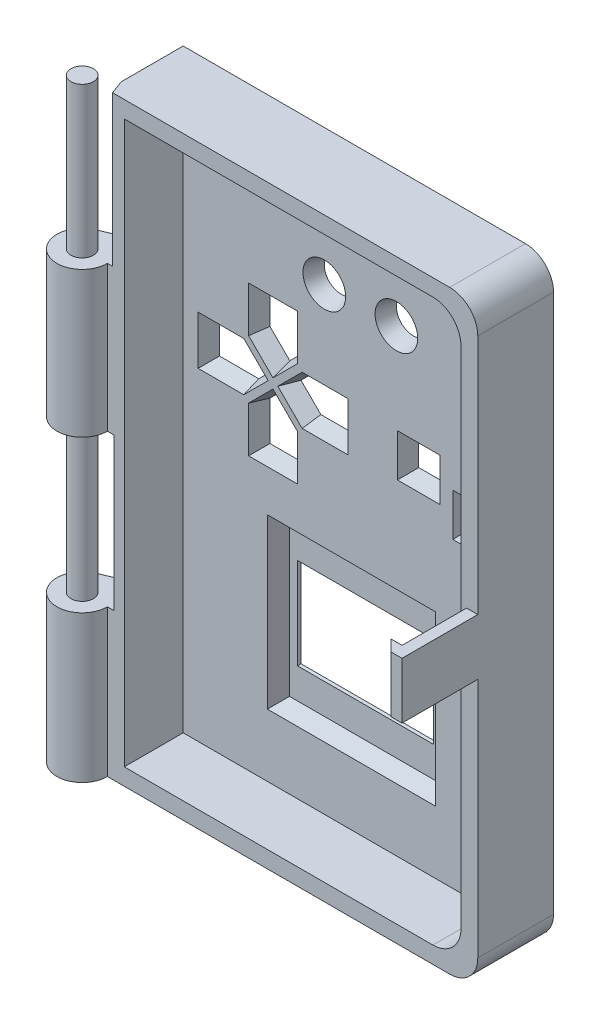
SolidWorks part; units mm, degrees
ref_plane "Plan de face" through (0, 0, 0) normal (0, 0, 1) x (1, 0, 0)
ref_plane "Plan de dessus" through (0, 0, 0) normal (0, 1, 0) x (1, 0, 0)
ref_plane "Plan de droite" through (0, 0, 0) normal (1, 0, 0) x (0, 0, -1)
sketch "Esquisse2" plane through (0, 0, 0) normal (0, 0, 1) x (1, 0, 0)
  line L0 (-33, -53) -> (-33, 53)
  line L1 (-30, -50) -> (30, -50) construction
  line L2 (-30, -50) -> (-30, 50) construction
  line L3 (-30, 50) -> (30, 50) construction
  line L4 (30, -50) -> (30, 50) construction
  line L5 (-30, -50) -> (30, 50) construction
  line L6 (-30, 50) -> (30, -50) construction
  line L7 (-33, 53) -> (33, 53)
  line L8 (33, -53) -> (33, 53)
  line L9 (-33, -53) -> (33, -53)
  point P0 (0, 0)
  dimension "D1" = 100
  dimension "D2" = 60
  dimension "D3" = 3
extrude "Boss.-Extru.2" add sketch "Esquisse2" along normal blind 13.5
shell "Coque1" thickness 3
sketch "Esquisse3" plane through (0, -53, 0) normal (0, -1, 0) x (1, 0, 0)
  line L1 (-39.2308, 9.3462) -> (-33, 6.75)
  line L2 (-33, 13.5) -> (-33, 0) construction
  circle A0 centre (-37.5, 13.5) radius 3
  arc A1 (-39.2308, 9.3462) -> (-33, 13.5) centre (-37.5, 13.5) cw
  dimension "D1" = 6
  dimension "D3" = 1.5
extrude "Boss.-Extru.3" add sketch "Esquisse3" against normal through all contours A1 L1 A0 M6 | A0
sketch "Esquisse4" plane through (0, 0, 0) normal (0, 0, -1) x (-1, 0, 0)
  line L5 (42, 0.3) -> (33, 0.3)
  line L10 (33, 53) -> (33, 26.5) construction
  line L11 (33, 53) -> (33, -53) construction
  line L12 (33, 26.5) -> (33, 0) construction
  line L13 (33, 0) -> (33, -26.5) construction
  line L14 (33, -26.5) -> (33, -53) construction
  line L15 (42, -53) -> (42, 53) construction
  line L16 (33, 53) -> (42, 53)
  line L17 (33, 53) -> (33, 26.2)
  line L18 (33, 26.2) -> (42, 26.2)
  line L19 (42, 53) -> (42, 26.2)
  line L20 (42, 0.3) -> (42, -26.8)
  line L21 (42, -26.8) -> (33, -26.8)
  line L22 (33, 0.3) -> (33, -26.8)
  dimension "D1" = 0.3
  dimension "D2" = 0.3
  dimension "D3" = 0.3
extrude "Enlèv. mat.-Extru.1" cut sketch "Esquisse4" against normal through all
sketch "Esquisse5" plane through (0, -53, 0) normal (0, -1, 0) x (1, 0, 0)
  circle A1 centre (-37.5, 13.5) radius 2
  point P3 (-37.5, 13.5)
  dimension "D1" = 4
extrude "Boss.-Extru.4" add sketch "Esquisse5" against normal through all
ref_plane "Plan1" through (0, 0, 0) normal (0, 1, 0) x (1, 0, 0)
sketch "Esquisse6" plane through (0, 0, 0) normal (0, 1, 0) x (1, 0, 0)
  line L0 (33, -13.5) -> (31, -13.5)
  line L1 (33, -13.5) -> (-33, -13.5) construction
  line L2 (31, -13.5) -> (31, -25)
  line L3 (31, -25) -> (29, -25)
  line L4 (29, -25) -> (31, -27)
  line L5 (31, -27) -> (33, -27)
  line L6 (33, -27) -> (33, -13.5)
  dimension "D1" = 2
  dimension "D2" = 2
  dimension "D3" = 2
  dimension "D4" = 11.5
extrude "Boss.-Extru.5" add sketch "Esquisse6" along normal mid plane 10
sketch "Esquisse7" plane through (0, 0, 0) normal (0, 0, -1) x (-1, 0, 0)
  line L0 (22, 11.92) -> (6, 11.92) construction
  line L1 (12, -31.84) -> (-12, -31.84)
  line L2 (12, -31.84) -> (12, -15.84)
  line L3 (12, -15.84) -> (-12, -15.84)
  line L4 (-12, -31.84) -> (-12, -15.84)
  line L5 (12, -31.84) -> (-12, -15.84) construction
  line L6 (12, -15.84) -> (-12, -31.84) construction
  line L8 (14, 3.92) -> (14, 19.92) construction
  line L9 (27, 38.5) -> (-27, 38.5) construction
  line L10 (27, 38.5) -> (27, -47) construction
  line L11 (27, -47) -> (-27, -47) construction
  line L12 (-27, 38.5) -> (-27, -47) construction
  line L13 (27, 38.5) -> (-27, -47) construction
  line L14 (27, -47) -> (-27, 38.5) construction
  line L15 (12, 11.92) -> (8.4645, 8.3845)
  line L16 (8.4645, 8.3845) -> (1.4645, 8.3845)
  line L17 (1.4645, 8.3845) -> (1.4645, 15.4555)
  line L18 (12, 11.92) -> (8.4645, 15.4555)
  line L19 (8.4645, 15.4555) -> (1.4645, 15.4555)
  line L20 (14, 13.92) -> (17.5355, 17.4555)
  line L21 (17.5355, 17.4555) -> (17.5355, 24.4555)
  line L22 (10.4645, 24.4555) -> (17.5355, 24.4555)
  line L23 (10.4645, 17.4555) -> (10.4645, 24.4555)
  line L24 (14, 13.92) -> (10.4645, 17.4555)
  line L25 (16, 11.92) -> (19.5355, 8.3845)
  line L26 (19.5355, 8.3845) -> (26.5355, 8.3845)
  line L27 (26.5355, 15.4555) -> (26.5355, 8.3845)
  line L28 (19.5355, 15.4555) -> (26.5355, 15.4555)
  line L29 (16, 11.92) -> (19.5355, 15.4555)
  line L30 (14, 9.92) -> (10.4645, 6.3845)
  line L31 (10.4645, 6.3845) -> (10.4645, -0.6155)
  line L32 (17.5355, -0.6155) -> (10.4645, -0.6155)
  line L33 (17.5355, 6.3845) -> (17.5355, -0.6155)
  line L34 (14, 9.92) -> (17.5355, 6.3845)
  line L35 (30, -50) -> (-30, -50) construction
  line L36 (-24.85, 10.68) -> (-18.85, 10.68)
  line L37 (-24.85, 10.68) -> (-24.85, 4.68)
  line L38 (-24.85, 4.68) -> (-18.85, 4.68)
  line L39 (-18.85, 10.68) -> (-18.85, 4.68)
  line L40 (-24.85, 10.68) -> (-18.85, 4.68) construction
  line L41 (-24.85, 4.68) -> (-18.85, 10.68) construction
  line L42 (-14.98, 14.92) -> (-8.98, 14.92)
  line L43 (-14.98, 14.92) -> (-14.98, 8.92)
  line L44 (-14.98, 8.92) -> (-8.98, 8.92)
  line L45 (-8.98, 14.92) -> (-8.98, 8.92)
  line L46 (-14.98, 14.92) -> (-8.98, 8.92) construction
  line L47 (-14.98, 8.92) -> (-8.98, 14.92) construction
  line L48 (30, -50) -> (-30, -50) construction
  circle A4 centre (-11.98, 11.92) radius 3 construction
  circle A5 centre (-21.85, 7.68) radius 3 construction
  circle A6 centre (4.85, 31.77) radius 3
  circle A7 centre (-8, 31.77) radius 3
  point P0 (0, -23.84)
  point P21 (14, 11.92)
  point P22 (14, 11.92)
  point P26 (0, -4.25)
  point P34 (1.4645, 11.92)
  point P37 (0, 38.5)
  point P56 (14, 11.92)
  dimension "D1" = 54
  dimension "D6" = 6
  dimension "D2" = 85.5
  dimension "D3" = 6.73
  dimension "D4" = 12.85
  dimension "D5" = 22.15
  dimension "D7" = 19.85
  dimension "D8" = 16
  dimension "D9" = 9.15
  dimension "D10" = 17.98
  dimension "D11" = 4.24
  dimension "D12" = 35.76
  dimension "D13" = 24
  dimension "D14" = 16
  dimension "D15" = 9.87
  dimension "D16" = 7
  dimension "D17" = 135
  dimension "D18" = 5
  dimension "D19" = 2
  dimension "D21" = 6
  dimension "D22" = 6
  dimension "D23" = 3
  dimension "D20" = 4
extrude "Enlèv. mat.-Extru.2" cut sketch "Esquisse7" against normal blind 4 draft 15
fillet "Congé1" radius 5 4 edges at (33, -53, 6.75) (30, -50, 8.25) (33, 53, 6.75) (30, 50, 8.25)
chamfer "Chanfrein1" distance 2.5 angle 20 1 edges at (-33, 39.6, 13.5)
chamfer "Chanfrein2" distance 2.5 angle 25 1 edges at (-33, -13.25, 13.5)
sketch "Esquisse9" plane through (0, 0, 0) normal (0, 0, -1) x (-1, 0, 0)
  line L0 (-33, 39.7591) -> (-33, 60.1772) construction
  line L1 (-33, -48) -> (-33, 48) construction
  line L2 (4.85, 31.77) -> (-8, 31.77) construction
  line L3 (-1.575, 31.77) -> (-1.575, 38.77) construction
  line L4 (13.425, 38.77) -> (-3.575, 38.77) construction
  line L5 (-3.575, 38.77) -> (-14.4308, 38.77) construction
  text T0 "Select" font "Century Gothic" height 3.5
  text T1 "Start"
  dimension "D1" = 7
  dimension "D2" = 15
  dimension "D3" = 2
extrude "Enlèv. mat.-Extru.3" cut sketch "Esquisse9" against normal blind 0.5
fillet "Congé2" radius 0.2 17 edges at (-13.1873, 38.0061, 0) (-11.458, 35.8803, 0)
fillet "Congé3" radius 0.2 14 edges at (-8.4043, 38.0356, 0) (-9.4149, 37.2444, 0) (-9.2744, 37.5585, 0)
fillet "Congé4" radius 0.2 4 edges at (-7.3897, 38.77, 0) (-7.2327, 36.9751, 0) (-7.3897, 35.1803, 0) (-7.5468, 36.9751, 0)
fillet "Congé5" radius 0.2 14 edges at (-5.2867, 37.2444, 0) (-5.1462, 37.5585, 0) (-4.2761, 38.0356, 0)
fillet "Congé6" radius 0.2 10 edges at (-0.9924, 38.1383, 0) (-0.9924, 36.8486, 0)
fillet "Congé7" radius 0.2 12 edges at (0.2385, 38.77, 0) (0.6199, 36.5264, 0) (0.8442, 36.3694, 0) (0.6199, 36.2123, 0) (0.3955, 35.6963, 0) (0.2385, 35.1803, 0) (0.0814, 35.6963, 0) (-0.1429, 36.2123, 0) (-0.3673, 36.3694, 0) (-0.1429, 36.5264, 0) (0.0814, 37.6482, 0) (0.3955, 37.6482, 0)
fillet "Congé8" radius 0.2 17 edges at (3.8127, 38.0061, 0) (5.542, 35.8803, 0)
fillet "Congé9" radius 0.2 12 edges at (7.2096, 36.5264, 0) (7.434, 36.3694, 0) (7.2096, 36.2123, 0) (6.9853, 35.6963, 0) (6.8282, 35.1803, 0) (6.6712, 35.6963, 0) (6.4468, 36.2123, 0) (6.2224, 36.3694, 0) (6.4468, 36.5264, 0) (6.6712, 37.6482, 0) (6.8282, 38.77, 0) (6.9853, 37.6482, 0)
fillet "Congé10" radius 0.2 13 edges at (10.3058, 38.5488, 0) (10.4628, 38.77, 0) (10.6199, 37.4912, 0) (10.4628, 36.2123, 0) (10.3058, 36.4489, 0)
fillet "Congé12" radius 0.2 23 edges at (13.2449, 38.77, 0) (13.4019, 37.6482, 0) (13.0878, 37.6482, 0) (12.8635, 36.5264, 0) (13.6263, 36.5264, 0) (13.8506, 36.3694, 0) (13.6263, 36.2123, 0) (13.4019, 35.6963, 0) (13.2449, 35.1803, 0) (13.0878, 35.6963, 0) (12.8635, 36.2123, 0) (12.6391, 36.3694, 0) (12.3734, 36.3911, 0) (11.5622, 38.3402, 0) (11.4051, 38.77, 0) (11.2481, 37.4912, 0) (11.4051, 36.2123, 0) (11.5622, 36.4006, 0)
sketch "Esquisse10" plane through (0, 0, 3) normal (0, 0, 1) x (1, 0, 0)
  line L0 (-12.8038, -15.0362) -> (12.8038, -32.6438) construction
  line L2 (-15, -8.84) -> (15, -8.84)
  line L3 (-15, -8.84) -> (-15, -38.84)
  line L4 (-15, -38.84) -> (15, -38.84)
  line L5 (15, -8.84) -> (15, -38.84)
  line L6 (-15, -8.84) -> (15, -38.84) construction
  line L7 (-15, -38.84) -> (15, -8.84) construction
  point P4 (0, -23.84)
  dimension "D1" = 30
  dimension "D2" = 30
extrude "Enlèv. mat.-Extru.4" cut sketch "Esquisse10" against normal blind 2.5 draft 30
